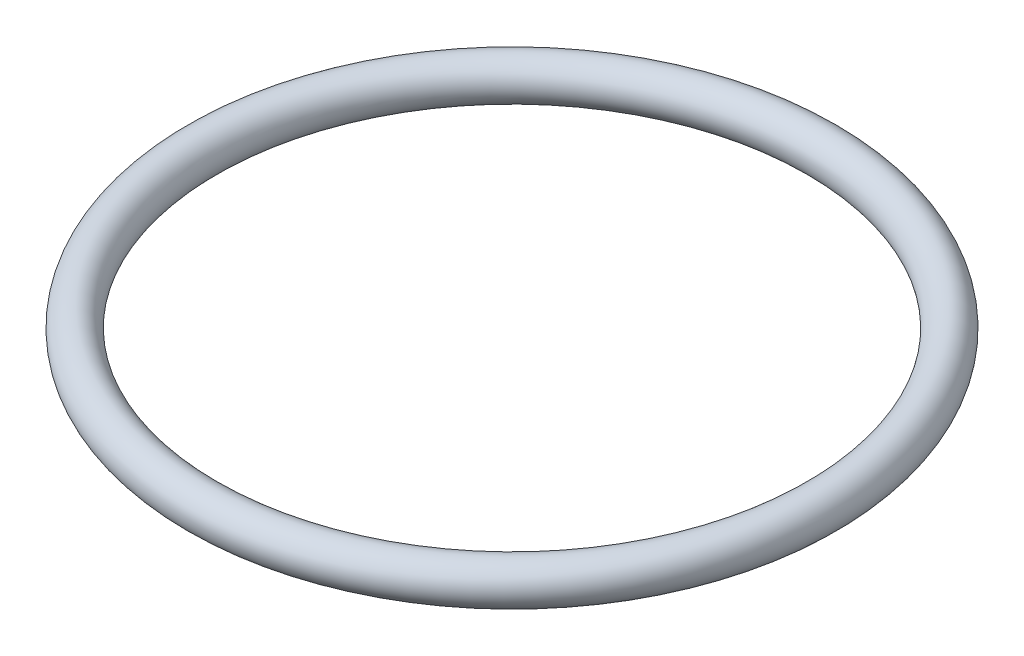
SolidWorks part; units mm, degrees
ref_plane "Front" through (0, 0, 0) normal (0, 0, 1) x (1, 0, 0)
ref_plane "Top" through (0, 0, 0) normal (0, 1, 0) x (1, 0, 0)
ref_plane "Right" through (0, 0, 0) normal (1, 0, 0) x (0, 0, -1)
sketch "Sketch1" plane through (0, 0, 0) normal (0, 0, 1) x (1, 0, 0)
  line L0 (0, 0) -> (0, 0.8322) construction
  circle A0 centre (7.747, 0) radius 0.508
  dimension "D2" = 1.016
  dimension "D1" = 7.747
revolve "Revolve1" add sketch "Sketch1" angle 360 about L0
